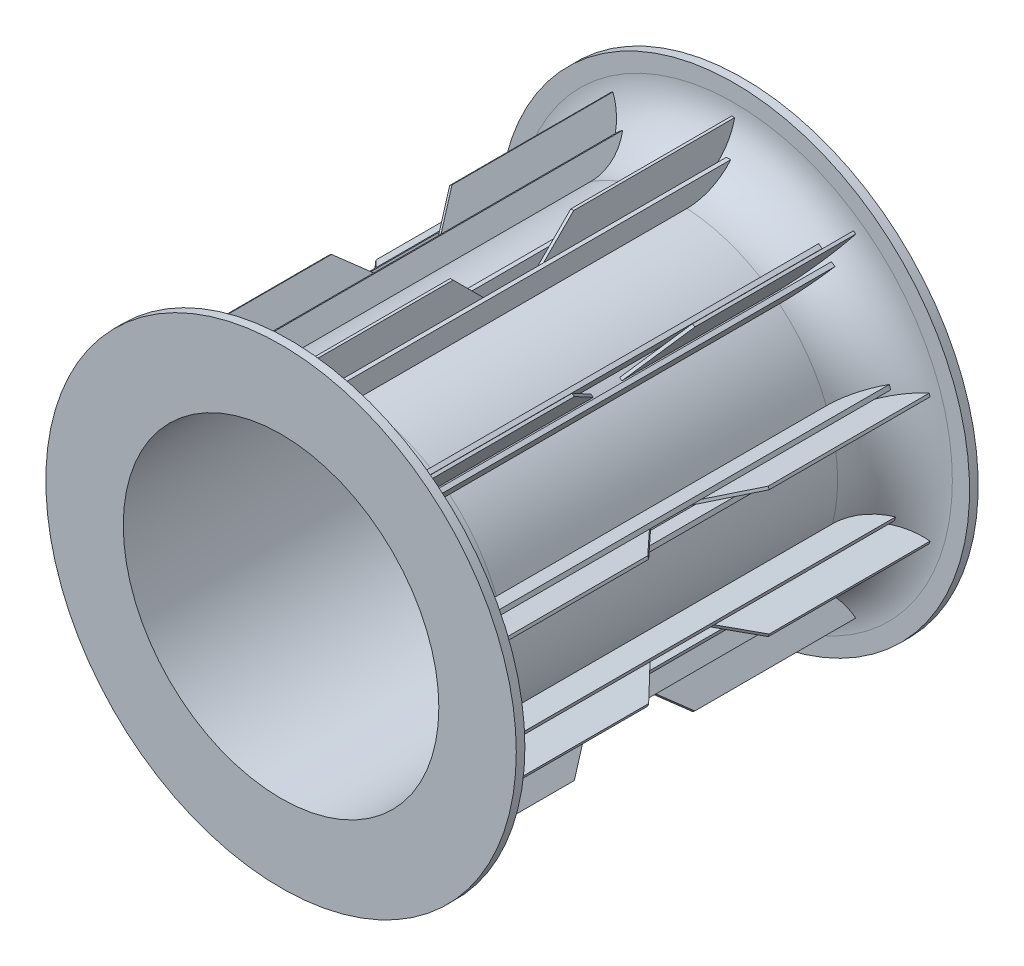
SolidWorks part; units mm, degrees
other "Carousel_Main"
ref_plane "Front Plane" through (0, 0, 0) normal (0, 0, 1) x (1, 0, 0)
ref_plane "Top Plane" through (0, 0, 0) normal (0, 1, 0) x (1, 0, 0)
ref_plane "Right Plane" through (0, 0, 0) normal (1, 0, 0) x (0, 0, -1)
imported_body "Imported3"
ref_plane "Plane1" through (0, 0, -42.5) normal (0, 0, -1) x (-1, 0, 0)
sketch "Sketch1" plane through (0, 0, -42.5) normal (0, 0, -1) x (-1, 0, 0)
  circle A0 centre (0, 0) radius 82
extrude "Boss-Extrude1" add sketch "Sketch1" against normal blind 3
hole_wizard "M100 Clearance Hole1" positions "Sketch3" profile "Sketch2" hole size "M100" standard "ANSI Metric"
sketch "Sketch3" plane through (0, 0, -39.5) normal (0, 0, 1) x (1, 0, 0)
  point P0 (0, 0)
sketch "Sketch2" plane through (0, 0, -39.5) normal (1, 0, 0) x (0, -1, 0)
  line L0 (0, 0) -> (0, 156)
  line L1 (0, 156) -> (55, 156)
  line L2 (55, 156) -> (55, 0)
  line L5 (55, 0) -> (0, 0)
  line L10 (0, 156) -> (-55, 156) construction
  line L11 (0, -6.35) -> (0, 107.95) construction
  dimension "Hole Dia." = 110
  dimension "Hole Depth" = 156
  dimension "Drill Angle" = 180
ref_plane "Plane2" through (0.8498, -2.6154, 0) normal (0.309, -0.9511, 0) x (0.9511, 0.309, 0)
sketch "Sketch4" plane through (0.8498, -2.6154, 0) normal (0.309, -0.9511, 0) x (0.9511, 0.309, 0)
  line L0 (62.9643, -192.7194) -> (62.9643, -47.2806)
rib "Rib1" sketch "Sketch4" sketch "Sketch4" thickness 1.5 extrusion direction parallel to sketch draft on no parameters "D1"=1.5
ref_plane "Plane3" through (0.8498, 2.6154, 0) normal (0.309, 0.9511, 0) x (-0.9511, 0.309, 0)
sketch "Sketch5" plane through (0.8498, 2.6154, 0) normal (0.309, 0.9511, 0) x (-0.9511, 0.309, 0)
  line L0 (62.9643, -192.7194) -> (62.9643, -47.2806)
rib "Rib2" sketch "Sketch5" sketch "Sketch5" thickness 1.5 extrusion direction parallel to sketch draft on no parameters "D1"=1.5
ref_plane "Plane4" through (-0.8498, 2.6154, 0) normal (-0.309, 0.9511, 0) x (-0.9511, -0.309, 0)
sketch "Sketch6" plane through (-0.8498, 2.6154, 0) normal (-0.309, 0.9511, 0) x (-0.9511, -0.309, 0)
  line L0 (62.9643, -192.7194) -> (62.9643, -47.2806)
rib "Rib3" sketch "Sketch6" sketch "Sketch6" thickness 1.5 extrusion direction parallel to sketch draft on no parameters "D1"=1.5
ref_plane "Plane5" through (2.2248, 1.6164, 0) normal (0.809, 0.5878, 0) x (-0.5878, 0.809, 0)
sketch "Sketch7" plane through (2.2248, 1.6164, 0) normal (0.809, 0.5878, 0) x (-0.5878, 0.809, 0)
  line L0 (62.9643, -192.7194) -> (62.9643, -47.2806)
rib "Rib4" sketch "Sketch7" sketch "Sketch7" thickness 1.5 extrusion direction parallel to sketch draft on no parameters "D1"=1.5
ref_plane "Plane6" through (-0.8498, -2.6154, 0) normal (-0.309, -0.9511, 0) x (0.9511, -0.309, 0)
sketch "Sketch8" plane through (-0.8498, -2.6154, 0) normal (-0.309, -0.9511, 0) x (0.9511, -0.309, 0)
  line L0 (62.9643, -192.7194) -> (62.9643, -47.2806)
rib "Rib5" sketch "Sketch8" sketch "Sketch8" thickness 1.5 extrusion direction parallel to sketch draft on no parameters "D1"=1.5
ref_plane "Plane7" through (-2.2248, 1.6164, 0) normal (-0.809, 0.5878, 0) x (-0.5878, -0.809, 0)
sketch "Sketch9" plane through (-2.2248, 1.6164, 0) normal (-0.809, 0.5878, 0) x (-0.5878, -0.809, 0)
  line L0 (62.9643, -192.7194) -> (62.9643, -47.2806)
rib "Rib6" sketch "Sketch9" sketch "Sketch9" thickness 1.5 extrusion direction parallel to sketch draft on no parameters "D1"=1.5
ref_plane "Plane8" through (2.75, 0, 0) normal (1, 0, 0) x (0, 0, -1)
sketch "Sketch10" plane through (2.75, 0, 0) normal (1, 0, 0) x (0, 0, -1)
  line L0 (192.7194, 62.9643) -> (47.2806, 62.9643)
rib "Rib7" sketch "Sketch10" sketch "Sketch10" thickness 1.5 extrusion direction parallel to sketch draft on no parameters "D1"=1.5
ref_plane "Plane9" through (2.2248, -1.6164, 0) normal (0.809, -0.5878, 0) x (0.5878, 0.809, 0)
sketch "Sketch11" plane through (2.2248, -1.6164, 0) normal (0.809, -0.5878, 0) x (0.5878, 0.809, 0)
  line L0 (62.9643, -192.7194) -> (62.9643, -47.2806)
rib "Rib8" sketch "Sketch11" sketch "Sketch11" thickness 1.5 extrusion direction parallel to sketch draft on no parameters "D1"=1.5
ref_plane "Plane10" through (-2.2248, -1.6164, 0) normal (-0.809, -0.5878, 0) x (0.5878, -0.809, 0)
sketch "Sketch12" plane through (-2.2248, -1.6164, 0) normal (-0.809, -0.5878, 0) x (0.5878, -0.809, 0)
  line L0 (62.9643, -192.7194) -> (62.9643, -47.2806)
rib "Rib9" sketch "Sketch12" sketch "Sketch12" thickness 1.5 extrusion direction parallel to sketch draft on no parameters "D1"=1.5
ref_plane "Plane11" through (-2.75, 0, 0) normal (-1, 0, 0) x (0, -1, 0)
sketch "Sketch13" plane through (-2.75, 0, 0) normal (-1, 0, 0) x (0, -1, 0)
  line L0 (62.9643, -192.7194) -> (62.9643, -47.2806)
rib "Rib10" sketch "Sketch13" sketch "Sketch13" thickness 1.5 extrusion direction parallel to sketch draft on no parameters "D1"=1.5
ref_plane "Plane12" through (-2.75, 0, 0) normal (1, 0, 0) x (0, 0, -1)
sketch "Sketch14" plane through (-2.75, 0, 0) normal (1, 0, 0) x (0, 0, -1)
  line L0 (192.7194, 62.9643) -> (47.2806, 62.9643)
rib "Rib11" sketch "Sketch14" sketch "Sketch14" thickness 1.5 extrusion direction parallel to sketch draft on no parameters "D1"=1.5
ref_plane "Plane13" through (-0.8498, 2.6154, 0) normal (0.309, -0.9511, 0) x (0.9511, 0.309, 0)
sketch "Sketch15" plane through (-0.8498, 2.6154, 0) normal (0.309, -0.9511, 0) x (0.9511, 0.309, 0)
  line L0 (62.9643, -192.7194) -> (62.9643, -47.2806)
rib "Rib12" sketch "Sketch15" sketch "Sketch15" thickness 1.5 extrusion direction parallel to sketch draft on no parameters "D1"=1.5
ref_plane "Plane14" through (2.2248, -1.6164, 0) normal (-0.809, 0.5878, 0) x (-0.5878, -0.809, 0)
sketch "Sketch16" plane through (2.2248, -1.6164, 0) normal (-0.809, 0.5878, 0) x (-0.5878, -0.809, 0)
  line L0 (62.9643, -192.7194) -> (62.9643, -47.2806)
rib "Rib13" sketch "Sketch16" sketch "Sketch16" thickness 1.5 extrusion direction parallel to sketch draft on no parameters "D1"=1.5
ref_plane "Plane15" through (-2.2248, 1.6164, 0) normal (0.809, -0.5878, 0) x (0.5878, 0.809, 0)
sketch "Sketch17" plane through (-2.2248, 1.6164, 0) normal (0.809, -0.5878, 0) x (0.5878, 0.809, 0)
  line L0 (62.9643, -192.7194) -> (62.9643, -47.2806)
rib "Rib14" sketch "Sketch17" sketch "Sketch17" thickness 1.5 extrusion direction parallel to sketch draft on no parameters "D1"=1.5
ref_plane "Plane16" through (2.2248, 1.6164, 0) normal (-0.809, -0.5878, 0) x (0.5878, -0.809, 0)
sketch "Sketch18" plane through (2.2248, 1.6164, 0) normal (-0.809, -0.5878, 0) x (0.5878, -0.809, 0)
  line L0 (62.9643, -192.7194) -> (62.9643, -47.2806)
rib "Rib15" sketch "Sketch18" sketch "Sketch18" thickness 1.5 extrusion direction parallel to sketch draft on no parameters "D1"=1.5
ref_plane "Plane17" through (-2.2248, -1.6164, 0) normal (0.809, 0.5878, 0) x (-0.5878, 0.809, 0)
sketch "Sketch19" plane through (-2.2248, -1.6164, 0) normal (0.809, 0.5878, 0) x (-0.5878, 0.809, 0)
  line L0 (62.9643, -192.7194) -> (62.9643, -47.2806)
rib "Rib16" sketch "Sketch19" sketch "Sketch19" thickness 1.5 extrusion direction parallel to sketch draft on no parameters "D1"=1.5
ref_plane "Plane18" through (0.8498, -2.6154, 0) normal (-0.309, 0.9511, 0) x (-0.9511, -0.309, 0)
sketch "Sketch20" plane through (0.8498, -2.6154, 0) normal (-0.309, 0.9511, 0) x (-0.9511, -0.309, 0)
  line L0 (62.9643, -192.7194) -> (62.9643, -47.2806)
rib "Rib17" sketch "Sketch20" sketch "Sketch20" thickness 1.5 extrusion direction parallel to sketch draft on no parameters "D1"=1.5
ref_plane "Plane19" through (2.75, 0, 0) normal (-1, 0, 0) x (0, -1, 0)
sketch "Sketch21" plane through (2.75, 0, 0) normal (-1, 0, 0) x (0, -1, 0)
  line L0 (62.9643, -192.7194) -> (62.9643, -47.2806)
rib "Rib18" sketch "Sketch21" sketch "Sketch21" thickness 1.5 extrusion direction parallel to sketch draft on no parameters "D1"=1.5
ref_plane "Plane20" through (0.8498, 2.6154, 0) normal (-0.309, -0.9511, 0) x (0.9511, -0.309, 0)
sketch "Sketch22" plane through (0.8498, 2.6154, 0) normal (-0.309, -0.9511, 0) x (0.9511, -0.309, 0)
  line L0 (62.9643, -192.7194) -> (62.9643, -47.2806)
rib "Rib19" sketch "Sketch22" sketch "Sketch22" thickness 1.5 extrusion direction parallel to sketch draft on no parameters "D1"=1.5
ref_plane "Plane21" through (-0.8498, -2.6154, 0) normal (0.309, 0.9511, 0) x (-0.9511, 0.309, 0)
sketch "Sketch23" plane through (-0.8498, -2.6154, 0) normal (0.309, 0.9511, 0) x (-0.9511, 0.309, 0)
  line L0 (62.9643, -192.7194) -> (62.9643, -47.2806)
rib "Rib20" sketch "Sketch23" sketch "Sketch23" thickness 1.5 extrusion direction parallel to sketch draft on no parameters "D1"=1.5
ref_plane "Plane22" through (0, 0, 0) normal (-0.809, 0.5878, 0) x (-0.5878, -0.809, 0)
sketch "Sketch24" plane through (0, 0, 0) normal (-0.809, 0.5878, 0) x (-0.5878, -0.809, 0)
  line L0 (-72, -42.9041) -> (-72, -99)
  line L1 (-72, -99) -> (-56, -115)
rib "Rib21" sketch "Sketch24" sketch "Sketch24" thickness 1 extrusion direction parallel to sketch draft on no parameters "D1"=1
ref_plane "Plane23" through (0, 0, 0) normal (0.809, -0.5878, 0) x (0.5878, 0.809, 0)
sketch "Sketch25" plane through (0, 0, 0) normal (0.809, -0.5878, 0) x (0.5878, 0.809, 0)
  line L0 (-72, -42.9041) -> (-72, -99)
  line L1 (-72, -99) -> (-56, -115)
rib "Rib22" sketch "Sketch25" sketch "Sketch25" thickness 1 extrusion direction parallel to sketch draft on no parameters "D1"=1
ref_plane "Plane24" through (0, 0, 0) normal (-0.809, -0.5878, 0) x (0.5878, -0.809, 0)
sketch "Sketch26" plane through (0, 0, 0) normal (-0.809, -0.5878, 0) x (0.5878, -0.809, 0)
  line L0 (-72, -42.9041) -> (-72, -99)
  line L1 (-72, -99) -> (-56, -115)
rib "Rib23" sketch "Sketch26" sketch "Sketch26" thickness 1 extrusion direction parallel to sketch draft on no parameters "D1"=1
ref_plane "Plane25" through (0, 0, 0) normal (0.809, 0.5878, 0) x (-0.5878, 0.809, 0)
sketch "Sketch27" plane through (0, 0, 0) normal (0.809, 0.5878, 0) x (-0.5878, 0.809, 0)
  line L0 (-72, -42.9041) -> (-72, -99)
  line L1 (-72, -99) -> (-56, -115)
rib "Rib24" sketch "Sketch27" sketch "Sketch27" thickness 1 extrusion direction parallel to sketch draft on no parameters "D1"=1
sketch "Sketch28" plane through (0, 0, 0) normal (0.809, 0.5878, 0) x (-0.5878, 0.809, 0)
  line L0 (-56, -125) -> (-72, -141)
  line L1 (-72, -141) -> (-72, -197.0959)
rib "Rib25" sketch "Sketch28" sketch "Sketch28" thickness 1 extrusion direction parallel to sketch draft on no parameters "D1"=1
sketch "Sketch29" plane through (0, 0, 0) normal (-0.809, -0.5878, 0) x (0.5878, -0.809, 0)
  line L0 (-56, -125) -> (-72, -141)
  line L1 (-72, -141) -> (-72, -197.0959)
rib "Rib26" sketch "Sketch29" sketch "Sketch29" thickness 1 extrusion direction parallel to sketch draft on no parameters "D1"=1
sketch "Sketch30" plane through (0, 0, 0) normal (-0.809, 0.5878, 0) x (-0.5878, -0.809, 0)
  line L0 (-56, -125) -> (-72, -141)
  line L1 (-72, -141) -> (-72, -197.0959)
rib "Rib27" sketch "Sketch30" sketch "Sketch30" thickness 1 extrusion direction parallel to sketch draft on no parameters "D1"=1
sketch "Sketch31" plane through (0, 0, 0) normal (0.809, -0.5878, 0) x (0.5878, 0.809, 0)
  line L0 (-56, -125) -> (-72, -141)
  line L1 (-72, -141) -> (-72, -197.0959)
rib "Rib28" sketch "Sketch31" sketch "Sketch31" thickness 1 extrusion direction parallel to sketch draft on no parameters "D1"=1
ref_plane "Plane26" through (0, 0, 0) normal (0.309, 0.9511, 0) x (-0.9511, 0.309, 0)
sketch "Sketch32" plane through (0, 0, 0) normal (0.309, 0.9511, 0) x (-0.9511, 0.309, 0)
  line L0 (-72, -42.9041) -> (-72, -99)
  line L1 (-72, -99) -> (-56, -115)
rib "Rib29" sketch "Sketch32" sketch "Sketch32" thickness 1 extrusion direction parallel to sketch draft on no parameters "D1"=1
ref_plane "Plane27" through (0, 0, 0) normal (-0.309, -0.9511, 0) x (0.9511, -0.309, 0)
sketch "Sketch33" plane through (0, 0, 0) normal (-0.309, -0.9511, 0) x (0.9511, -0.309, 0)
  line L0 (-72, -42.9041) -> (-72, -99)
  line L1 (-72, -99) -> (-56, -115)
rib "Rib30" sketch "Sketch33" sketch "Sketch33" thickness 1 extrusion direction parallel to sketch draft on no parameters "D1"=1
ref_plane "Plane28" through (0, 0, 0) normal (0.309, -0.9511, 0) x (0.9511, 0.309, 0)
sketch "Sketch34" plane through (0, 0, 0) normal (0.309, -0.9511, 0) x (0.9511, 0.309, 0)
  line L0 (-72, -42.9041) -> (-72, -99)
  line L1 (-72, -99) -> (-56, -115)
rib "Rib31" sketch "Sketch34" sketch "Sketch34" thickness 1 extrusion direction parallel to sketch draft on no parameters "D1"=1
ref_plane "Plane29" through (0, 0, 0) normal (-0.309, 0.9511, 0) x (-0.9511, -0.309, 0)
sketch "Sketch35" plane through (0, 0, 0) normal (-0.309, 0.9511, 0) x (-0.9511, -0.309, 0)
  line L0 (-72, -42.9041) -> (-72, -99)
  line L1 (-72, -99) -> (-56, -115)
rib "Rib32" sketch "Sketch35" sketch "Sketch35" thickness 1 extrusion direction parallel to sketch draft on no parameters "D1"=1
sketch "Sketch36" plane through (0, 0, 0) normal (0.309, 0.9511, 0) x (-0.9511, 0.309, 0)
  line L0 (-56, -125) -> (-72, -141)
  line L1 (-72, -141) -> (-72, -197.0959)
rib "Rib33" sketch "Sketch36" sketch "Sketch36" thickness 1 extrusion direction parallel to sketch draft on no parameters "D1"=1
sketch "Sketch37" plane through (0, 0, 0) normal (-0.309, -0.9511, 0) x (0.9511, -0.309, 0)
  line L0 (-56, -125) -> (-72, -141)
  line L1 (-72, -141) -> (-72, -197.0959)
rib "Rib34" sketch "Sketch37" sketch "Sketch37" thickness 1 extrusion direction parallel to sketch draft on no parameters "D1"=1
sketch "Sketch38" plane through (0, 0, 0) normal (0.309, -0.9511, 0) x (0.9511, 0.309, 0)
  line L0 (-56, -125) -> (-72, -141)
  line L1 (-72, -141) -> (-72, -197.0959)
rib "Rib35" sketch "Sketch38" sketch "Sketch38" thickness 1 extrusion direction parallel to sketch draft on no parameters "D1"=1
sketch "Sketch39" plane through (0, 0, 0) normal (-0.309, 0.9511, 0) x (-0.9511, -0.309, 0)
  line L0 (-56, -125) -> (-72, -141)
  line L1 (-72, -141) -> (-72, -197.0959)
rib "Rib36" sketch "Sketch39" sketch "Sketch39" thickness 1 extrusion direction parallel to sketch draft on no parameters "D1"=1
sketch "Sketch40" plane through (0, 0, 0) normal (1, 0, 0) x (0, 0, -1)
  line L0 (42.9041, -72) -> (99, -72)
  line L1 (99, -72) -> (115, -56)
rib "Rib37" sketch "Sketch40" sketch "Sketch40" thickness 1 extrusion direction parallel to sketch draft on no parameters "D1"=1
ref_plane "Plane30" through (0, 0, 0) normal (-1, 0, 0) x (0, -1, 0)
sketch "Sketch41" plane through (0, 0, 0) normal (-1, 0, 0) x (0, -1, 0)
  line L0 (-72, -42.9041) -> (-72, -99)
  line L1 (-72, -99) -> (-56, -115)
rib "Rib38" sketch "Sketch41" sketch "Sketch41" thickness 1 extrusion direction parallel to sketch draft on no parameters "D1"=1
sketch "Sketch42" plane through (0, 0, 0) normal (1, 0, 0) x (0, 0, -1)
  line L0 (125, -56) -> (141, -72)
  line L1 (141, -72) -> (197.0959, -72)
rib "Rib39" sketch "Sketch42" sketch "Sketch42" thickness 1 extrusion direction parallel to sketch draft on no parameters "D1"=1
sketch "Sketch43" plane through (0, 0, 0) normal (-1, 0, 0) x (0, -1, 0)
  line L0 (-56, -125) -> (-72, -141)
  line L1 (-72, -141) -> (-72, -197.0959)
rib "Rib40" sketch "Sketch43" sketch "Sketch43" thickness 1 extrusion direction parallel to sketch draft on no parameters "D1"=1
